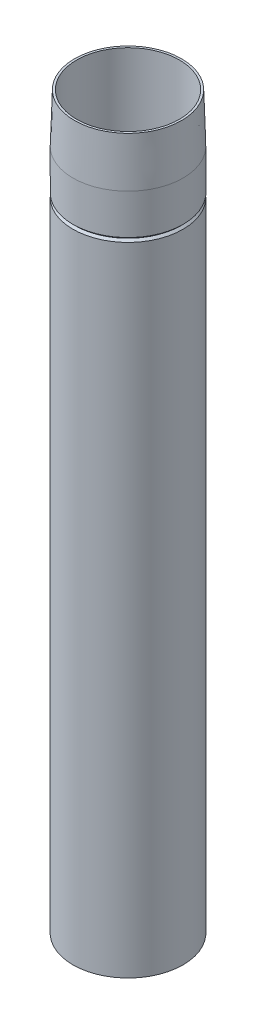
SolidWorks part; units mm, degrees
ref_plane "Plan1" through (0, 0, 0) normal (0, 0, 1) x (1, 0, 0)
ref_plane "Plan2" through (0, 0, 0) normal (0, 1, 0) x (1, 0, 0)
ref_plane "Plan3" through (0, 0, 0) normal (1, 0, 0) x (0, 0, -1)
sketch "Esquisse1" plane through (0, 0, 0) normal (0, 1, 0) x (1, 0, 0)
  circle A0 centre (0, 0) radius 30.15
  circle A1 centre (0, 0) radius 28.15
  dimension "D1" = 60.3
  dimension "D2" = 2
extrude "Extrusion1" add sketch "Esquisse1" along normal blind 400
sketch "Esquisse2" plane through (99.1313, 400, -81.5527) normal (0, 1, 0) x (-1, 0, 0)
  line L0 (99.1313, 81.5527) -> (72.0369, 81.5527)
  line L1 (99.1313, 81.5527) -> (99.1313, 82.7504)
  circle A0 centre (99.1313, 81.5527) radius 30.15 construction
ref_plane "Plan11" through (0, 400, 0) normal (0, 0, 1) x (-1, 0, 0)
sketch "Esquisse3" plane through (15.2241, 400, 0) normal (0, 0, 1) x (1, 0, 0)
  line L0 (14.0864, 0) -> (17.2759, 0)
  line L1 (17.2759, 0) -> (17.2759, -45)
  line L3 (17.2759, -46.5) -> (13.7759, -50)
  line L4 (13.7759, -50) -> (17.2759, -53.5)
  line L5 (17.2759, -53.5) -> (17.2759, -46.5)
  line L6 (14.9259, 0) -> (-45.3741, 0) construction
  line L7 (-15.2241, 4.2913) -> (-15.2241, -40.0252) construction
  line L8 (17.2759, -45) -> (15.4926, -45)
  line L9 (15.4926, -45) -> (14.0864, 0)
  dimension "D1" = 58.621
  dimension "D2" = 65
  dimension "D3" = 1.79
  dimension "D4" = 45
  dimension "D5" = 58
  dimension "D6" = 50
revolve "Enlèvement de matière-Révolution1" cut sketch "Esquisse3" angle 360 about L7
other "09-Embout_Male_2_PdG1"
